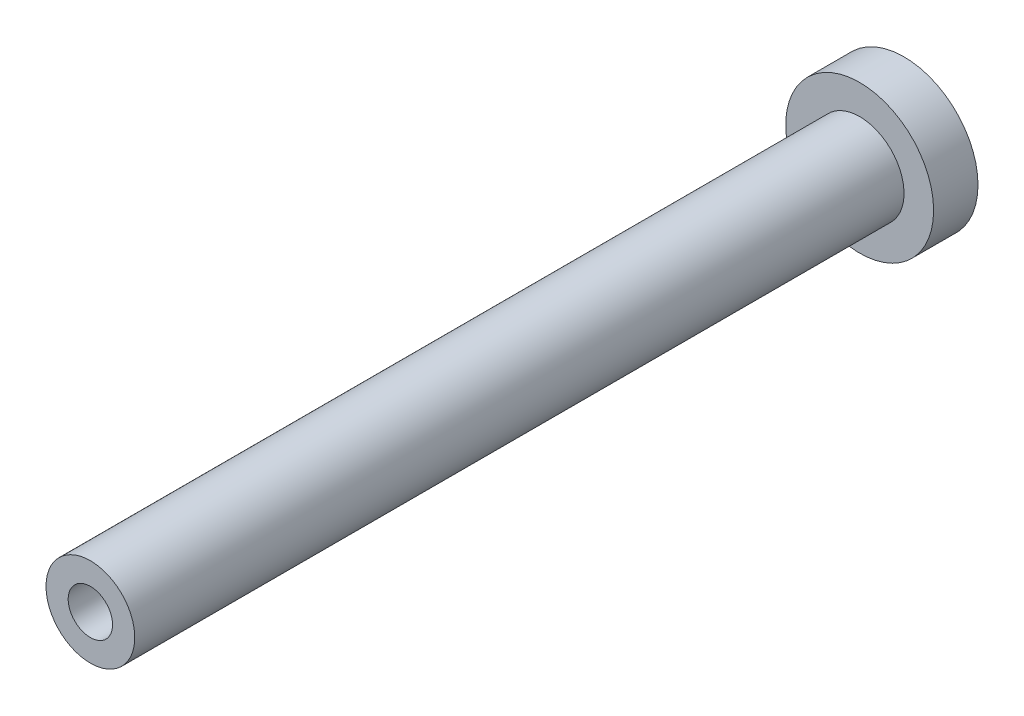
SolidWorks part; units mm, degrees
ref_plane "前视基准面" through (0, 0, 0) normal (0, 0, 1) x (1, 0, 0)
ref_plane "上视基准面" through (0, 0, 0) normal (0, 1, 0) x (1, 0, 0)
ref_plane "右视基准面" through (0, 0, 0) normal (1, 0, 0) x (0, 0, -1)
sketch "草图1" plane through (0, 0, 0) normal (0, 0, 1) x (1, 0, 0)
  circle A0 centre (0, 0) radius 5
extrude "凸台-拉伸1" add sketch "草图1" along normal blind 3
sketch "草图2" plane through (0, 0, 3) normal (0, 0, 1) x (1, 0, 0)
  circle A0 centre (0, 0) radius 3
  dimension "D1" = 6
extrude "凸台-拉伸2" add sketch "草图2" along normal blind 52
sketch "草图3" plane through (0, 0, 55) normal (0, 0, 1) x (1, 0, 0)
  circle A0 centre (0, 0) radius 1.5
extrude "切除-拉伸1" cut sketch "草图3" against normal blind 15
